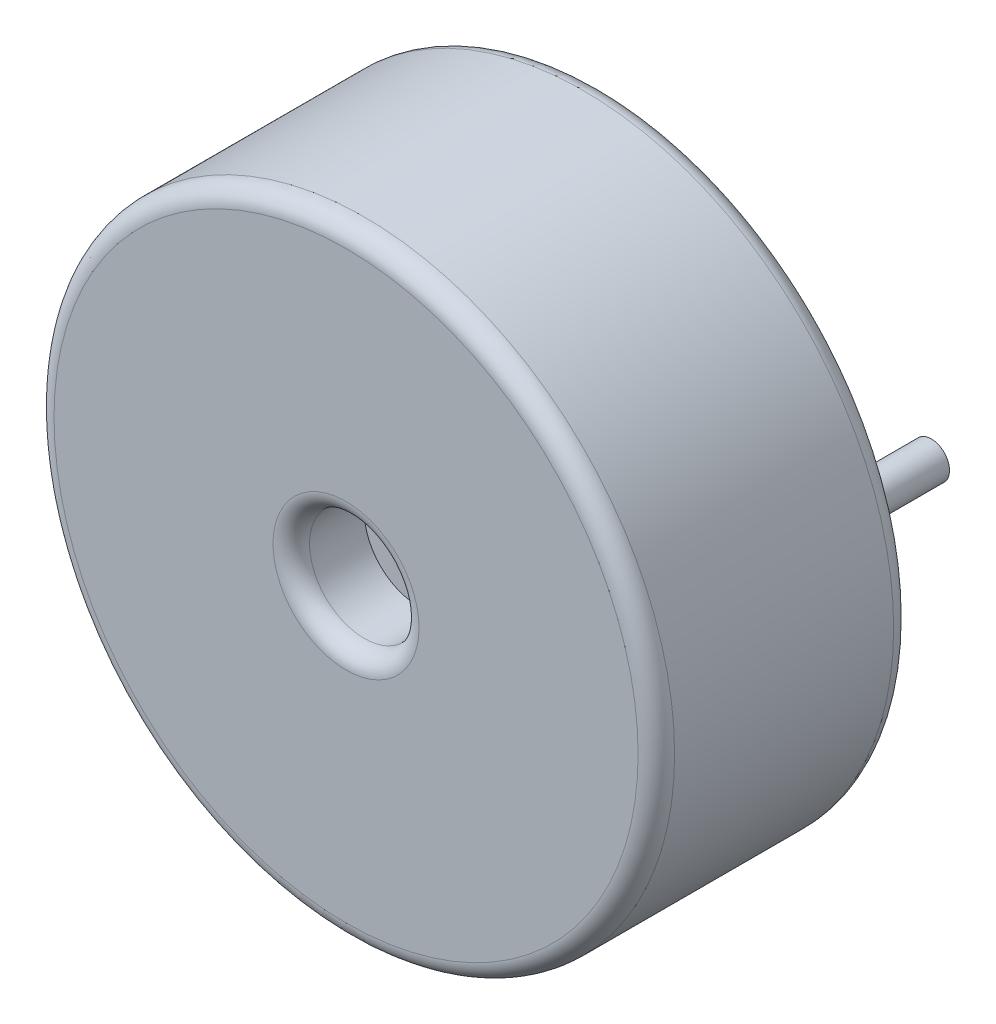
SolidWorks part; units mm, degrees
ref_plane "Face" through (0, 0, 0) normal (0, 0, 1) x (1, 0, 0)
ref_plane "Dessus" through (0, 0, 0) normal (0, 1, 0) x (1, 0, 0)
ref_plane "Droite" through (0, 0, 0) normal (1, 0, 0) x (0, 0, -1)
sketch "Esquisse1" plane through (0, 0, 0) normal (0, 0, 1) x (1, 0, 0)
  circle A0 centre (0, 0) radius 8.5
  dimension "D1" = 17
extrude "Extrusion1" add sketch "Esquisse1" along normal blind 7
sketch "Esquisse2" plane through (0, 0, 7) normal (0, 0, 1) x (1, 0, 0)
  circle A0 centre (0, 0) radius 1.5
  circle A1 centre (0, 0) radius 8.5 construction
  dimension "D1" = 3
extrude "Enlèv. mat.-Extru.1" cut sketch "Esquisse2" against normal blind 2
sketch "Esquisse3" plane through (0, 0, 0) normal (0, 0, -1) x (-1, 0, 0)
  line L0 (-8.5, 0) -> (8.5, 0) construction
  line L1 (0, 8.5) -> (0, -8.5) construction
  circle A0 centre (0, 0) radius 8.5 construction
  circle A1 centre (-5.03, 0) radius 0.5
  circle A2 centre (5.03, 0) radius 0.5
  dimension "D1" = 1
  dimension "D2" = 10.06
extrude "Extrusion2" add sketch "Esquisse3" along normal blind 4
fillet "Congé1" radius 0.5 3 edges at (8.5, 0, 0) (8.5, 0, 7) (1.5, 0, 7)
